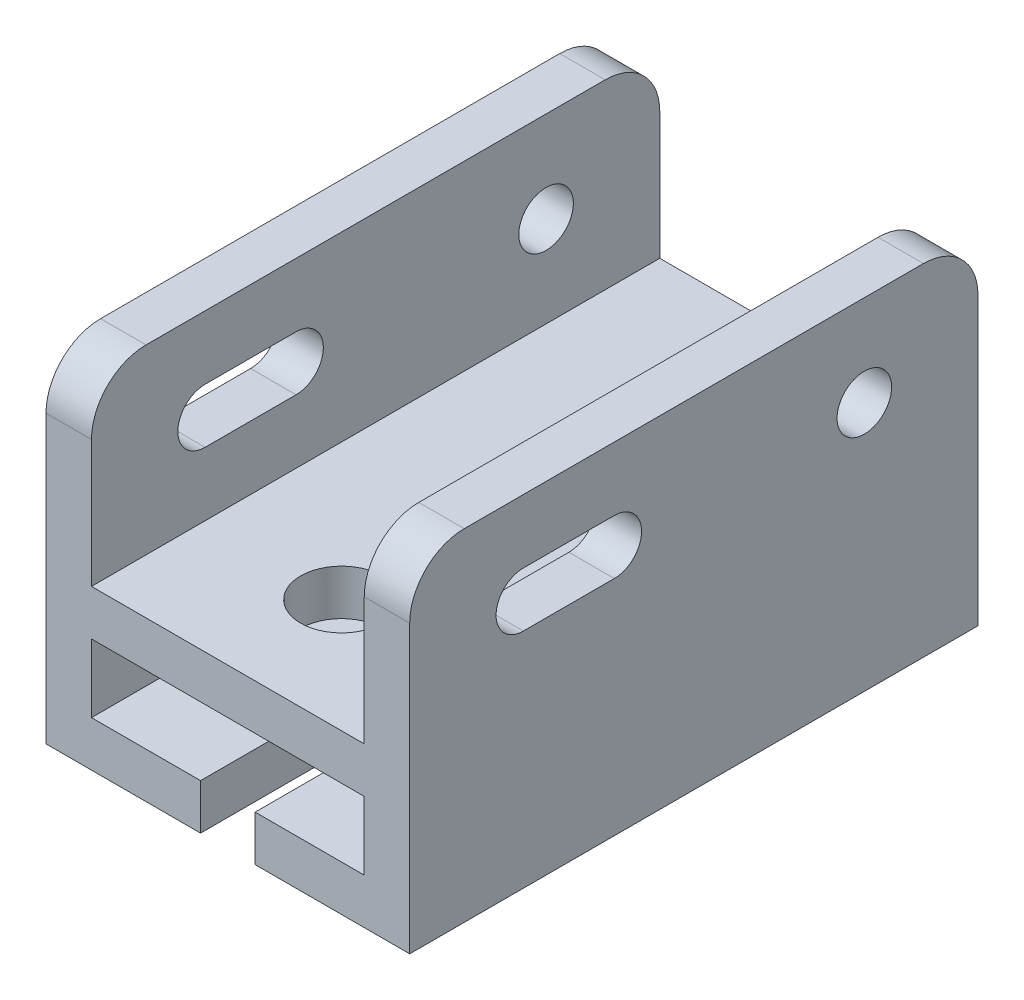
SolidWorks part; units mm, degrees
ref_plane "Front Plane" through (0, 0, 0) normal (0, 0, 1) x (1, 0, 0)
ref_plane "Top Plane" through (0, 0, 0) normal (0, 1, 0) x (1, 0, 0)
ref_plane "Right Plane" through (0, 0, 0) normal (1, 0, 0) x (0, 0, -1)
sketch "Sketch1" plane through (0, 0, 0) normal (0, 0, 1) x (1, 0, 0)
  line L0 (0, 0) -> (0, 75)
  line L1 (0, -55) -> (0, 55) construction
  line L2 (0, 75) -> (10, 75)
  line L3 (10, 75) -> (10, 35)
  line L4 (10, 35) -> (70, 35)
  line L5 (70, 35) -> (70, 75)
  line L6 (70, 75) -> (80, 75)
  line L7 (80, 75) -> (80, 0)
  line L8 (55, 0) -> (-55, 0) construction
  line L9 (80, 0) -> (46, 0)
  line L10 (46, 0) -> (46, 10)
  line L11 (46, 10) -> (70, 10)
  line L12 (70, 10) -> (70, 25)
  line L13 (70, 25) -> (10, 25)
  line L14 (10, 25) -> (10, 10)
  line L15 (10, 10) -> (34, 10)
  line L16 (34, 10) -> (34, 0)
  line L17 (34, 0) -> (0, 0)
  dimension "D1" = 80
  dimension "D2" = 75
  dimension "D3" = 34
  dimension "D4" = 34
  dimension "D5" = 15
  dimension "D6" = 10
  dimension "D7" = 10
extrude "Extrude1" add sketch "Sketch1" against normal blind 125
other "Hole1"
sketch "Sketch2" plane through (0, 35, 0) normal (0, 1, 0) x (-1, 0, 0)
  line L0 (-70, 0) -> (-10, 0) construction
  circle A0 centre (-40, -25) radius 9
  dimension "D1" = 18
  dimension "D2" = 30
  dimension "D3" = 25
pattern_linear "LPattern1" count 2 spacing 75 along (0, 0, -1) of "Hole1"
sketch "Sketch3" plane through (80, 0, 0) normal (1, 0, 0) x (0, 0, -1)
  line L0 (45, 61) -> (25, 61)
  line L1 (25, 49) -> (45, 49)
  circle A0 centre (100, 55) radius 6
  arc A1 (25, 61) -> (25, 49) centre (25, 55) ccw
  arc A2 (45, 49) -> (45, 61) centre (45, 55) ccw
  dimension "D5" = 12
  dimension "D1" = 25
  dimension "D2" = 20
  dimension "D3" = 25
  dimension "D4" = 55
extrude "Cut-Extrude1" cut sketch "Sketch3" against normal through all
fillet "Fillet1" radius 12 4 edges at (5, 75, 0) (75, 75, 0) (75, 75, -125) (5, 75, -125)
